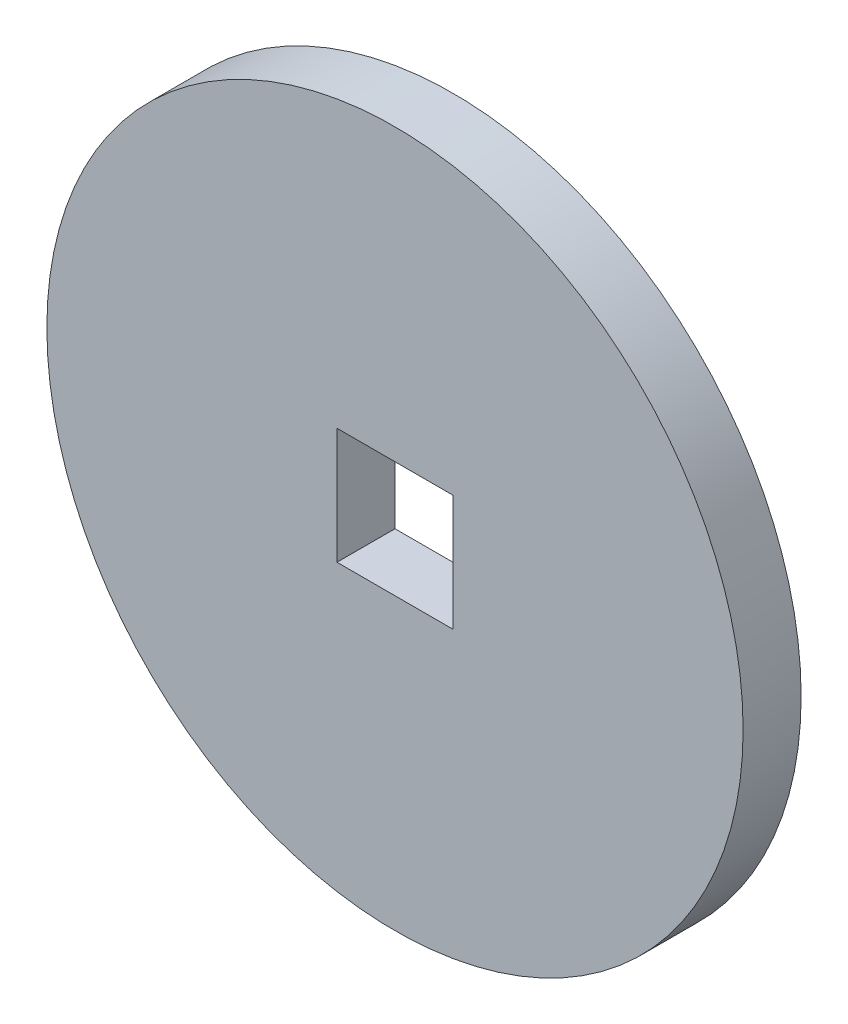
SolidWorks part; units mm, degrees
ref_plane "Front Plane" through (0, 0, 0) normal (0, 0, 1) x (1, 0, 0)
ref_plane "Top Plane" through (0, 0, 0) normal (0, 1, 0) x (1, 0, 0)
ref_plane "Right Plane" through (0, 0, 0) normal (1, 0, 0) x (0, 0, -1)
sketch "Sketch1" plane through (0, 0, 0) normal (0, 0, 1) x (1, 0, 0)
  line L1 (-42.8811, 24.5883) -> (-36.5311, 24.5883)
  line L2 (-42.8811, 24.5883) -> (-42.8811, 30.9383)
  line L3 (-42.8811, 30.9383) -> (-36.5311, 30.9383)
  line L4 (-36.5311, 24.5883) -> (-36.5311, 30.9383)
  line L5 (-42.8811, 24.5883) -> (-36.5311, 30.9383) construction
  line L6 (-42.8811, 30.9383) -> (-36.5311, 24.5883) construction
  circle A0 centre (-39.7061, 27.7633) radius 19.05
  dimension "D1" = 38.1
  dimension "D2" = 6.35
  dimension "D3" = 6.35
extrude "Boss-Extrude1" add sketch "Sketch1" along normal blind 3.175
